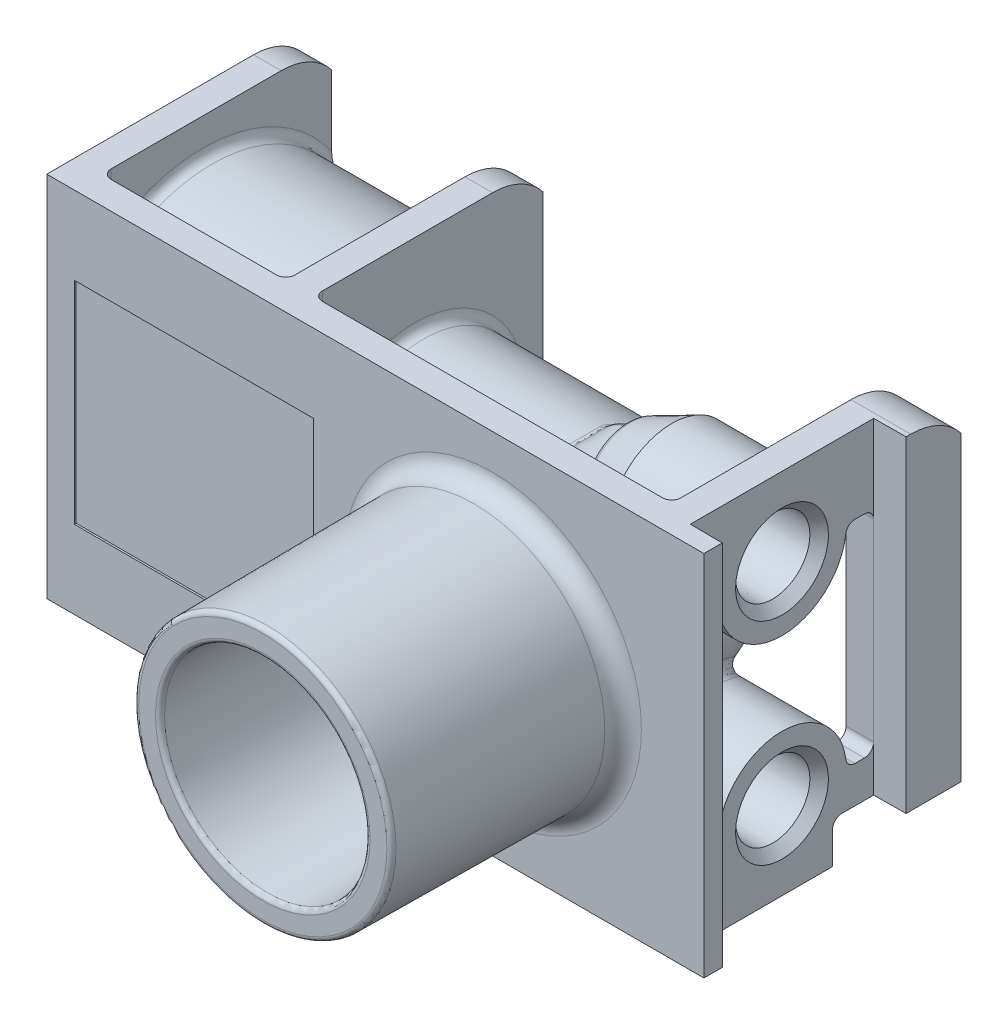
SolidWorks part; units mm, degrees
ref_plane "Plan de face" through (0, 0, 0) normal (0, 0, 1) x (1, 0, 0)
ref_plane "Plan de dessus" through (0, 0, 0) normal (0, 1, 0) x (1, 0, 0)
ref_plane "Plan de droite" through (0, 0, 0) normal (1, 0, 0) x (0, 0, -1)
sketch "Esquisse1" plane through (0, 0, 0) normal (0, 0, 1) x (1, 0, 0)
  line L1 (-64.8668, -0.5014) -> (6.6332, -0.5014)
  line L2 (-64.8668, -0.5014) -> (-64.8668, -40.5014)
  line L3 (-64.8668, -40.5014) -> (6.6332, -40.5014)
  line L4 (6.6332, -0.5014) -> (6.6332, -40.5014)
  dimension "D1" = 71.5
  dimension "D2" = 40
extrude "Extrusion1" add sketch "Esquisse1" against normal blind 3
sketch "Esquisse2" plane through (6.6332, 0, 0) normal (1, 0, 0) x (0, 0, -1)
  line L0 (3, -40.5014) -> (3, -0.5014) construction
  line L1 (3, -40.5014) -> (28, -40.5014)
  line L2 (3, -40.5014) -> (3, -0.5014)
  line L3 (3, -0.5014) -> (28, -0.5014)
  line L4 (28, -40.5014) -> (28, -0.5014)
  line L5 (3, -40.5014) -> (0, -40.5014) construction
  line L6 (3, -0.5014) -> (0, -0.5014) construction
  dimension "D1" = 25
extrude "Extrusion2" add sketch "Esquisse2" against normal blind 6.5
sketch "Esquisse3" plane through (6.6332, 0, 0) normal (1, 0, 0) x (0, 0, -1)
  line L1 (2, -41.9443) -> (22, -41.9443)
  line L2 (2, -41.9443) -> (2, 1.2411)
  line L3 (2, 1.2411) -> (22, 1.2411)
  line L4 (22, -41.9443) -> (22, 1.2411)
  line L6 (0, -40.5014) -> (0, -0.5014) construction
  dimension "D1" = 2
  dimension "D2" = 20
extrude "Enlèv. mat.-Extru.1" cut sketch "Esquisse3" against normal blind 3.5 draft 0.5
sketch "Esquisse4" plane through (-64.8668, 0, 0) normal (-1, 0, 0) x (0, 0, 1)
  line L0 (-28, -0.5014) -> (-28, -40.5014)
  line L1 (-28, -0.5014) -> (-3, -0.5014)
  line L2 (-28, -40.5014) -> (-3, -40.5014)
  line L3 (-3, -0.5014) -> (-3, -40.5014)
extrude "Extrusion3" add sketch "Esquisse4" against normal blind 3
sketch "Esquisse8" plane through (-64.8668, 0, 0) normal (-1, 0, 0) x (0, 0, 1)
  line L0 (0, -20.5014) -> (-24.0316, -20.5014) construction
  line L1 (0, -0.5014) -> (0, -40.5014) construction
  line L2 (-14, -15.5521) -> (-14, -25.5172) construction
  line L4 (-28, -0.5014) -> (-28, -40.5014) construction
  line L5 (-28, -12.7887) -> (-28, -28.2806)
  line L6 (0, -12.7887) -> (0, -28.2806)
  circle A0 centre (-14, -20.5346) radius 12.95
  arc A1 (0, -12.7887) -> (-28, -12.7887) centre (-14, -20.5346) ccw
  arc A2 (-28, -28.2806) -> (0, -28.2806) centre (-14, -20.5346) ccw
  dimension "D2" = 25.9
  dimension "D1" = 14
extrude "Extrusion5" add sketch "Esquisse8" against normal blind 26
sketch "Esquisse9" plane through (-64.8668, 0, 0) normal (-1, 0, 0) x (0, 0, 1)
  circle A0 centre (-14, -20.5346) radius 12.95
  arc A1 (-3, -13.7007) -> (-3, -27.3686) centre (-14, -20.5346) ccw construction
extrude "Enlèv. mat.-Extru.4" cut sketch "Esquisse9" against normal blind 23
sketch "Esquisse10" plane through (-38.8668, 0, 0) normal (1, 0, 0) x (0, 0, -1)
  line L0 (3, -8.9157) -> (3, -32.1536)
  line L2 (3, -8.9157) -> (3, -13.7007)
  line L4 (3, -27.3686) -> (3, -32.1536)
  line L5 (28, -28.2806) -> (28, -12.7887)
  line L8 (28, -28.2806) -> (28, -12.7887)
  arc A3 (28, -12.7887) -> (3, -8.9157) centre (14, -20.5346) ccw
  arc A4 (3, -27.3686) -> (3, -13.7007) centre (14, -20.5346) ccw
  arc A5 (3, -32.1536) -> (28, -28.2806) centre (14, -20.5346) ccw
  arc A6 (28, -12.7887) -> (3, -8.9157) centre (14, -20.5346) ccw
  arc A8 (3, -32.1536) -> (28, -28.2806) centre (14, -20.5346) ccw
  dimension "D1" = 0
extrude "Extrusion6" add sketch "Esquisse10" against normal blind 3
sketch "Esquisse11" plane through (-38.8668, 0, 0) normal (1, 0, 0) x (0, 0, -1)
  circle A0 centre (14, -20.5346) radius 8
  circle A1 centre (14, -20.5346) radius 11.01
extrude "Extrusion11" add sketch "Esquisse11" along normal blind 35
sketch "Esquisse21" plane through (0, -0.5014, 0) normal (0, 1, 0) x (-1, 0, 0)
  line L0 (27.3668, -3) -> (1.7447, -28.6221)
  line L1 (-0.1332, -3) -> (61.8668, -3) construction
  line L2 (27.3668, -3) -> (1.7447, -3)
  line L3 (1.7447, -3) -> (1.7447, -28.6221)
  dimension "D1" = 45
extrude "Enlèv. mat.-Extru.6" cut sketch "Esquisse21" against normal blind 35
sketch "Esquisse22" plane through (0, 0, 0) normal (0, 0, 1) x (1, 0, 0)
  line L1 (-27.3668, -20.0655) -> (-27.3668, -21.0038)
  line L2 (-27.3668, -20.0655) -> (-27.3668, -21.0038)
  circle A0 centre (-16.3668, -20.5346) radius 8 construction
  arc A1 (-27.3668, -21.0038) -> (-27.3668, -20.0655) centre (-16.3668, -20.5346) ccw
  arc A2 (-27.3668, -21.0038) -> (-27.3668, -20.0655) centre (-16.3668, -20.5346) ccw
  circle A3 centre (-16.3668, -20.5346) radius 8
  dimension "D1" = 0
extrude "Extrusion13" add sketch "Esquisse22" against normal up to surface (3 mm away)
sketch "Esquisse23" plane through (0, 0, 0) normal (0, 0, 1) x (1, 0, 0)
  line L0 (6.6332, -40.5014) -> (6.6332, -0.5014) construction
  circle A0 centre (-16.3668, -20.5014) radius 8
  dimension "D1" = 23
  dimension "D2" = 16
extrude "Enlèv. mat.-Extru.7" cut sketch "Esquisse23" against normal blind 3
ref_plane "Plan2" through (3.3166, 0, 3.3166) normal (0.7071, 0, 0.7071) x (0.7071, 0, -0.7071)
ref_plane "Plan3" through (-15.1884, 0, -15.1884) normal (0.7071, 0, 0.7071) x (0.7071, 0, -0.7071)
ref_plane "Plan4" through (-16.35, 0, 0) normal (1, 0, 0) x (0, 0, -1)
sketch "Esquisse26" plane through (-16.35, 0, 0) normal (1, 0, 0) x (0, 0, -1)
  line L0 (14, -9.5346) -> (14, -12.5346)
  line L1 (14, -28.5346) -> (14, -31.5346)
  line L2 (14, -5.5173) -> (14, -36.6039) construction
  arc A0 (14, -28.5346) -> (14, -12.5346) centre (14, -20.5346) ccw
  arc A1 (14, -31.5346) -> (14, -9.5346) centre (14, -20.5346) ccw
revolve "Révolution3" add sketch "Esquisse26" angle 80 about L2
fillet "Congé8" radius 11 1 edges at (-5.3568, -20.5346, -25.01)
sketch "Esquisse29" plane through (-15.1884, 0, -15.1884) normal (0.7071, 0, 0.7071) x (0.7071, 0, -0.7071)
  arc A0 (8.9912, -17.7858) -> (8.9427, -23.4676) centre (-6.2699, -20.4965) cw
  arc A1 (8.9912, -17.7858) -> (8.9427, -23.4676) centre (4.9828, -20.5926) cw
  spline S0 degree 3 poles (12.1313, -2031.3287) (-23.5012, -11.7673) (-12.084, -32.0247) (-1.0434, -31.5279) (-0.7411, -31.5065) (-0.4482, -31.4776) (-0.1647, -31.4421) (0.1096, -31.4005) (0.3747, -31.3537) (0.6306, -31.3021) (0.8773, -31.2463) (1.1148, -31.1869) (1.3429, -31.1246) (1.5615, -31.0598) (1.7707, -30.9933) (1.9716, -30.9249) (2.1674, -30.8543) (2.3609, -30.7802) (2.5539, -30.7022) (2.7464, -30.6201) (2.9383, -30.5338) (3.1297, -30.4434) (3.3204, -30.3488) (3.5104, -30.2498) (3.6997, -30.1465) (3.8882, -30.0388) (4.0758, -29.9266) (4.2625, -29.8098) (4.4481, -29.6885) (4.6325, -29.5626) (4.8157, -29.4319) (4.9975, -29.2966) (5.1778, -29.1564) (5.3565, -29.0115) (5.9672, -28.4945) (6.9008, -27.5312) (7.9346, -26.0145) (8.6795, -24.4203) (9.2953, -22.2912) (9.4618, -19.4403) (8.674, -16.3497) (7.1615, -13.78) (5.3038, -11.8814) (3.1138, -10.5122) (1.3165, -9.8962) (0.1055, -9.6632) (-0.4989, -9.5823) (-14.1435, -8.4558) (-28.8923, -38.6012) (42.6003, 1989.8096) knots -0.932697 -0.932697 -0.932697 -0.932697 0.009309 0.018343 0.027113 0.035631 0.043902 0.051933 0.059726 0.067285 0.074608 0.081695 0.088542 0.095147 0.101504 0.107609 0.113581 0.119579 0.125606 0.131664 0.137756 0.143883 0.150047 0.156249 0.162493 0.168778 0.175107 0.18148 0.1879 0.194366 0.20088 0.207443 0.214054 0.220715 0.227425 0.283564 0.336531 0.386173 0.435781 0.528386 0.630576 0.707885 0.785004 0.859006 0.930291 0.948493 0.966102 0.983236 2.136919 2.136919 2.136919 2.136919 only from (-1.6736, -31.5446) to (-1.6736, -9.5246) construction
extrude "Enlèv. mat.-Extru.8" cut sketch "Esquisse29" against normal mid plane 3
sketch "Esquisse30" plane through (-41.8668, 0, 0) normal (-1, 0, 0) x (0, 0, 1)
  circle A0 centre (-14, -20.5346) radius 8.225
  dimension "D1" = 16.45
extrude "Enlèv. mat.-Extru.9" cut sketch "Esquisse30" against normal blind 25.5 draft 0.5
sketch "Esquisse31" plane through (0, 0, 0) normal (0, 0, 1) x (1, 0, 0)
  line L0 (-16.3668, -12.5322) -> (-16.3668, -28.5371) construction
  circle A0 centre (-16.3668, -20.5346) radius 10.87
  circle A1 centre (-16.3668, -20.5346) radius 14
  dimension "D1" = 21.74
extrude "Extrusion14" add sketch "Esquisse31" along normal blind 25
chamfer "Chanfrein1" distance 2.9 angle 45.5 1 edges at (-8.3668, -20.5014, 0)
draft "Dépouille15" type of draft neutral plane draft angle 0.72 faces to draft 1 parameters "D1"=0.72
draft "Dépouille16" type of draft neutral plane draft angle 0.5 faces to draft 1 parameters "D1"=0.5
sketch "Esquisse32" plane through (3.1332, 0, 0) normal (1, 0, 0) x (0, 0, -1)
  line L0 (-2.9013, -20.5014) -> (32.837, -20.5014) construction
  line L1 (21.9695, -0.5014) -> (2.0305, -0.5014) construction
  line L2 (2.0305, -40.5014) -> (21.9695, -40.5014) construction
  line L3 (28, -40.5014) -> (28, -0.5014) construction
  circle A0 centre (12, -9.0014) radius 7
  circle A1 centre (12, -32.0014) radius 7
  dimension "D1" = 23
  dimension "D2" = 16
extrude "Extrusion15" add sketch "Esquisse32" against normal blind 12
sketch "Esquisse33" plane through (-8.8668, 0, 0) normal (-1, 0, 0) x (0, 0, 1)
  line L1 (-14.0068, -12.4742) -> (-5.9222, -12.4742)
  line L2 (-14.0068, -12.4742) -> (-5.9222, -12.4742)
  arc A2 (-14.0068, -12.4742) -> (-17.5344, -13.2875) centre (-14.0067, -20.5323) ccw
  arc A3 (-5.9222, -12.4742) -> (-17.5344, -13.2875) centre (-12, -9.0014) ccw
  arc A4 (-14.0068, -12.4742) -> (-17.5344, -13.2875) centre (-14.0067, -20.5323) ccw
  arc A5 (-5.9222, -12.4742) -> (-17.5344, -13.2875) centre (-12, -9.0014) ccw
  dimension "D1" = 0
extrude "Extrusion16" add sketch "Esquisse33" along normal blind 5 draft 25
sketch "Esquisse34" plane through (-8.8668, 0, 0) normal (-1, 0, 0) x (0, 0, 1)
  line L1 (-5.8847, -28.595) -> (-14.0068, -28.595)
  line L2 (-5.8847, -28.595) -> (-14.0068, -28.595)
  arc A2 (-17.5715, -27.7637) -> (-14.0068, -28.595) centre (-14.0067, -20.537) ccw
  arc A3 (-17.5715, -27.7637) -> (-5.8847, -28.595) centre (-12, -32.0014) ccw
  arc A4 (-17.5715, -27.7637) -> (-14.0068, -28.595) centre (-14.0067, -20.537) ccw
  arc A5 (-17.5715, -27.7637) -> (-5.8847, -28.595) centre (-12, -32.0014) ccw
  dimension "D1" = 0
extrude "Extrusion17" add sketch "Esquisse34" along normal blind 5 draft 25
sketch "Esquisse35" plane through (0, 0, -3) normal (0, 0, -1) x (-1, 0, 0)
  line L0 (12.3566, -10.5225) -> (20.2801, -10.381)
  arc A0 (12.3566, -10.5225) -> (20.2801, -10.381) centre (16.3597, -12.7687) cw
  spline S0 degree 3 poles (16.3668, -9.5246) (16.3468, -9.5246) (16.3468, -31.5446) (16.3668, -31.5446) knots 0 0 0 0 1 1 1 1 weights 1 0.333333 0.333333 1 construction
extrude "Extrusion18" add sketch "Esquisse35" along normal blind 13.53
fillet "Congé12" radius 1 4 edges at (-10.8562, -11.0029, -6.267) (-6.7706, -15.1371, -8.6305) (-6.9892, -14.9946, -15.6168) (-11.0073, -11.5495, -17.4342)
fillet "Congé13" radius 1 3 edges at (-13.8668, -9.9022, -16.8713) (-13.8668, -4.3387, -12.2306)
fillet "Congé14" radius 1 1 edges at (-16.9637, -8.2183, -16.53)
fillet "Congé15" radius 1 5 edges at (-20.1642, -10.2002, -4.7044) (-19.4352, -9.7521, -16.2264)
fillet "Congé17" radius 1 3 edges at (-38.6118, -21.0038, -3) (-37.3632, -21.5603, -3) (-6.3992, -25.2107, -3)
sketch "Esquisse36" plane through (3.1332, 0, 0) normal (1, 0, 0) x (0, 0, -1)
  circle A0 centre (12, -9.0014) radius 4.05
  circle A1 centre (12, -32.0014) radius 4.05
  dimension "D1" = 8.1
  dimension "D2" = 8.1
extrude "Enlèv. mat.-Extru.10" cut sketch "Esquisse36" against normal blind 11.5 draft 0.5
chamfer "Chanfrein2" distance 1 angle 45 2 edges at (3.1332, -4.9514, -12) (3.1332, -27.9514, -12)
sketch "Esquisse37" plane through (0, 0, 0) normal (0, 0, 1) x (1, 0, 0)
  circle A0 centre (-16.3768, -10.7346) radius 1
  circle A3 centre (-16.3668, -20.5346) radius 14.2182 construction
  dimension "D1" = 9.8
  dimension "D2" = 2
sketch "Esquisse38" plane through (-8.3668, 0, 0) normal (1, 0, 0) x (0, 0, -1)
  line L0 (12, -8.6485) -> (12, -14.9077) construction
  circle A0 centre (12.0367, -10.8014) radius 0.7
  point P5 (12, -9.0014)
  dimension "D1" = 1.8
  dimension "D2" = 1.4
extrude "Enlèv. mat.-Extru.12" cut sketch "Esquisse38" against normal blind 9
sketch "Esquisse40" plane through (-13.8668, 0, 0) normal (-1, 0, 0) x (0, 0, 1)
  line L0 (-14.6685, -30.3736) -> (-9.3315, -30.3736)
  line L1 (-14.6685, -32.0014) -> (-14.6685, -30.3736)
  line L2 (-9.3315, -32.0014) -> (-9.3315, -30.3736)
  arc A0 (-9.3315, -32.0014) -> (-14.6685, -32.0014) centre (-12, -31.339) cw
extrude "Extrusion19" add sketch "Esquisse40" along normal blind 26
sketch "Esquisse41" plane through (-8.3668, 0, 0) normal (1, 0, 0) x (0, 0, -1)
  line L0 (11.9964, -29.3557) -> (11.9964, -34.0799) construction
  line L1 (13.6005, -32.0014) -> (10.1067, -32.0014) construction
  circle A0 centre (11.9964, -31.5014) radius 1.475
  dimension "D2" = 2.95
  dimension "D1" = 0.5
extrude "Enlèv. mat.-Extru.13" cut sketch "Esquisse41" against normal blind 36 draft 1
fillet "Congé22" radius 1 2 edges at (-27.6165, -31.5243, -14.6685)
fillet "Congé23" radius 1 3 edges at (-16.2824, -31.5443, -9.3315) (-32.2832, -30.5059, -9.3315)
fillet "Congé26" radius 1 6 edges at (-6.5535, -25.5265, -9.34) (-10.7807, -29.3535, -17.5037) (-7.474, -26.5651, -16.4098) (-10.9575, -30.1242, -6.2748) (-13.8668, -31.257, -7.8747)
fillet "Congé27" radius 1 5 edges at (-14.2415, -31.3462, -16.668) (-14.1202, -31.7853, -7.2419) (-13.8668, -36.6674, -12.1512)
sketch "Esquisse42" plane through (6.6332, 0, 0) normal (1, 0, 0) x (0, 0, -1)
  line L0 (17.5, -36.0014) -> (17.5, -42.8158)
  line L1 (17.5, -36.0014) -> (30.8798, -36.0014)
  line L2 (17.5, -42.8158) -> (30.8798, -42.8158)
  line L3 (30.8798, -36.0014) -> (30.8798, -42.8158)
  line L4 (28, -40.5014) -> (28, -0.5014) construction
  line L5 (28, -40.5014) -> (22, -40.5014) construction
  dimension "D1" = 10.5
  dimension "D2" = 4.5
extrude "Enlèv. mat.-Extru.14" cut sketch "Esquisse42" against normal blind 30
sketch "Esquisse43" plane through (6.6332, 0, 0) normal (1, 0, 0) x (0, 0, -1)
  line L0 (2.0305, -20.5014) -> (34.5975, -20.5014) construction
  line L1 (2.0305, -0.5014) -> (2.0305, -40.5014) construction
  line L2 (28, -0.5014) -> (22, -0.5014) construction
  line L3 (28, -36.0014) -> (28, -0.5014) construction
  line L4 (22.5, -0.5014) -> (22.5, 1.989)
  line L5 (22.5, 1.989) -> (29.5, 1.989)
  line L6 (29.5, 1.989) -> (29.5, -7.5014)
  line L7 (29.5, -42.9919) -> (29.5, -33.5014)
  line L8 (22.5, -42.9919) -> (29.5, -42.9919)
  line L9 (22.5, -40.5014) -> (22.5, -42.9919)
  arc A0 (29.5, -7.5014) -> (22.5, -0.5014) centre (22.5, -7.5014) ccw
  arc A1 (29.5, -33.5014) -> (22.5, -40.5014) centre (22.5, -33.5014) cw
  dimension "D1" = 7
  dimension "D2" = 5.5
extrude "Enlèv. mat.-Extru.15" cut sketch "Esquisse43" against normal blind 80
fillet "Congé28" radius 1 1 edges at (-3.0805, -36.0014, -17.5)
sketch "Esquisse44" plane through (3.1332, 0, 0) normal (1, 0, 0) x (0, 0, -1)
  line L0 (5, -9.0014) -> (3, -9.0014)
  line L1 (3, -9.0014) -> (3, -32.0014)
  line L2 (3, -32.0014) -> (5, -32.0014)
  line L3 (19, -32.0014) -> (21.9695, -32.0014)
  line L4 (21.9695, -36.0014) -> (21.9695, -0.5014) construction
  line L5 (21.9695, -32.0014) -> (21.9695, -9.0014)
  line L6 (21.9695, -9.0014) -> (19, -9.0014)
  line L7 (3, -0.5014) -> (3, -40.5014) construction
  arc A0 (5, -9.0014) -> (19, -9.0014) centre (12, -9.0014) ccw
  arc A1 (19, -32.0014) -> (5, -32.0014) centre (12, -32.0014) ccw
  arc A2 (18.3522, -11.9424) -> (5.1901, -10.6217) centre (12, -9.0014) ccw construction
  arc A3 (5.1764, -30.4399) -> (18.3731, -29.1061) centre (12, -32.0014) ccw construction
extrude "Enlèv. mat.-Extru.16" cut sketch "Esquisse44" against normal blind 5
ref_plane "Plan5" through (0, -36.0014, 0) normal (0, -1, 0) x (1, 0, 0)
sketch "Esquisse45" plane through (0, -36.0014, 0) normal (0, -1, 0) x (1, 0, 0)
  line L0 (6.6332, -28) -> (6.6332, -22) construction
  line L1 (0.1332, -28) -> (6.6332, -28) construction
  line L2 (-36.3668, -17.5) -> (-40.8668, -17.5)
  line L3 (-36.3668, -26.5) -> (-40.8668, -26.5)
  line L4 (-40.8668, -17.5) -> (-40.8668, -26.5)
  arc A0 (-36.3668, -26.5) -> (-36.3668, -17.5) centre (-36.3668, -22) ccw
  dimension "D2" = 9
  dimension "D1" = 43
  dimension "D3" = 6
extrude "Extrusion20" add sketch "Esquisse45" against normal blind 15.5 draft 1
sketch "Esquisse46" plane through (-38.8668, 0, 0) normal (1, 0, 0) x (0, 0, -1)
  line L3 (28, -37.8315) -> (28, -28.2806)
  line L4 (3, -32.1536) -> (3, -40.5014)
  line L5 (3, -40.5014) -> (22.5, -40.5014)
  line L6 (28, -37.8315) -> (28, -28.2806)
  line L7 (3, -32.1536) -> (3, -40.5014)
  line L8 (3, -40.5014) -> (22.5, -40.5014)
  line L9 (22.5, -0.5014) -> (3, -0.5014)
  line L10 (3, -0.5014) -> (3, -8.9157)
  line L11 (28, -12.7887) -> (28, -3.1713)
  line L12 (22.5, -0.5014) -> (3, -0.5014)
  line L13 (3, -0.5014) -> (3, -8.9157)
  line L14 (28, -12.7887) -> (28, -3.1713)
  arc A2 (22.5, -40.5014) -> (28, -37.8315) centre (22.5, -33.5014) ccw
  arc A3 (3, -32.1536) -> (28, -28.2806) centre (14, -20.5346) ccw
  arc A4 (22.5, -40.5014) -> (28, -37.8315) centre (22.5, -33.5014) ccw
  arc A5 (3, -32.1536) -> (28, -28.2806) centre (14, -20.5346) ccw
  arc A6 (28, -3.1713) -> (22.5, -0.5014) centre (22.5, -7.5014) ccw
  arc A7 (28, -12.7887) -> (3, -8.9157) centre (14, -20.5346) ccw
  arc A8 (28, -3.1713) -> (22.5, -0.5014) centre (22.5, -7.5014) ccw
  arc A9 (28, -12.7887) -> (3, -8.9157) centre (14, -20.5346) ccw
  dimension "D1" = 0
  dimension "D2" = 0
extrude "Extrusion21" add sketch "Esquisse46" against normal blind 3
sketch "Esquisse47" plane through (0, -36.0014, 0) normal (0, -1, 0) x (1, 0, 0)
  circle A0 centre (-36.3668, -22) radius 4.5
extrude "Enlèv. mat.-Extru.17" cut sketch "Esquisse47" along normal blind 13
fillet "Congé29" radius 1 7 edges at (-38.8668, -33.8437, -3) (-38.8668, -26.2287, -3.7107) (-38.8668, -34.0884, -12) (-38.8668, -31.6297, -14.983) (-38.8668, -31.5621, -9.3315) (-38.8668, -30.609, -9.1894)
sketch "Esquisse48" plane through (-41.8668, 0, 0) normal (-1, 0, 0) x (0, 0, 1)
  circle A0 centre (-14, -20.5346) radius 8.225 construction
  circle A1 centre (-14, -20.5346) radius 8.225
extrude "Enlèv. mat.-Extru.18" cut sketch "Esquisse48" against normal blind 12 draft 0.5
fillet "Congé38" radius 0.9 1 edges at (-38.8668, -31.236, -16.5886)
fillet "Congé40" radius 1 14 edges at (-12.784, -10.8511, -17.8256) (-13.6708, -10.1612, -16.7517) (-13.8648, -9.1241, -16.093) (-13.8668, -8.9478, -15.7652) (-13.8668, -8.9143, -11.7495) (-12.591, -10.1481, -5.7975) (-12.5506, -10.2072, -4.7291) (-12.7029, -9.9941, -3.4745) (-17.3293, -8.282, -3) (-20.1969, -10.1702, -3) (-21.163, -10.6242, -3) (-37.2011, -19.3869, -3) (-38.6118, -20.0655, -3)
fillet "Congé41" radius 1 3 edges at (-61.8668, -4.7232, -16.4495) (-51.8668, -8.9157, -3) (-41.8668, -4.7232, -16.4495)
fillet "Congé42" radius 1 3 edges at (-61.8668, -36.346, -16.4495) (-41.8668, -36.346, -16.4495) (-51.8668, -32.1536, -3)
fillet "Congé46" radius 10 8 edges at (-8.8775, -23.4664, -21.5247) (-8.3884, -17.9857, -21.1522) (-9.2606, -18.0448, -22.0379) (-9.7228, -20.625, -22.7753) (-7.6014, -20.625, -20.654)
ref_plane "Plan6" through (0, -5.0014, 0) normal (0, 1, 0) x (-1, 0, 0)
ref_plane "Plan7" through (0, -36.0014, 0) normal (0, -1, 0) x (1, 0, 0)
sketch "Esquisse53" plane through (-41.8668, 0, 0) normal (-1, 0, 0) x (0, 0, 1)
  circle A0 centre (-14, -20.5346) radius 7.725
  circle A2 centre (-14, -20.5346) radius 9.125
  circle A3 centre (-14, -20.5346) radius 9.125
  dimension "D1" = 0.9
extrude "Enlèv. mat.-Extru.22" cut sketch "Esquisse53" against normal blind 3.5 draft 0.5
draft "Dépouille17" type of draft neutral plane draft angle 0.5 faces to draft 1 parameters "D1"=0.5
fillet "Congé47" radius 2 1 edges at (-2.1486, -20.5346, 0)
fillet "Congé48" radius 0.5 2 edges at (-5.1826, -20.5346, 25) (-2.3668, -20.5346, 25)
extrude "Enlèv. mat.-Extru.23" cut sketch "Esquisse37" against normal blind 14 draft 0.5
sketch "Esquisse55" plane through (-41.8668, 0, 0) normal (-1, 0, 0) x (0, 0, 1)
  line L0 (-13.2242, -32.1031) -> (-14.713, -29.0995)
  line L1 (-10.2821, -31.5168) -> (-10.07, -28.1779)
  line L2 (-14, -20.5346) -> (-11.2161, -34.3831) construction
  line L3 (-14, -20.5346) -> (-14, -37.0988) construction
  circle A0 centre (-14, -20.5346) radius 8.5945 construction
  arc A1 (-13.2242, -32.1031) -> (-10.2821, -31.5168) centre (-14, -20.5346) ccw
  circle A2 centre (-14, -20.5346) radius 8.5945
  arc A3 (-14.713, -29.0995) -> (-10.07, -28.1779) centre (-14, -20.5346) ccw
  circle A4 centre (-14, -20.5346) radius 11.5945 construction
  dimension "D3" = 3
  dimension "D4" = 30
  dimension "D5" = 15
  dimension "D6" = 11.367
  dimension "D1" = 0.5
  dimension "D2" = 3
sketch "Esquisse56" plane through (-38.3668, 0, 0) normal (-1, 0, 0) x (0, 0, 1)
  circle A1 centre (-14, -20.5346) radius 8.3945
  circle A2 centre (-14, -20.5346) radius 9.2945
  circle A3 centre (-14, -20.5346) radius 9.2945
  dimension "D1" = 0.2
  dimension "D2" = 0.9
extrude "Extrusion22" add sketch "Esquisse56" along normal blind 0.5 draft 0.5
sketch "Esquisse57" plane through (-41.8668, 0, 0) normal (-1, 0, 0) x (0, 0, 1)
  circle A1 centre (-14, -20.5346) radius 12.0493
  arc A2 (-1.0507, -20.5346) -> (-1.0507, -20.5346) centre (-14, -20.5346) ccw
  circle A3 centre (-14, -20.5346) radius 12.9493
  dimension "D1" = 0.2
  dimension "D2" = 0.9
extrude "Extrusion23" add sketch "Esquisse57" along normal blind 1.4 draft 0.5
sketch "Esquisse62" plane through (-41.8668, 0, 0) normal (-1, 0, 0) x (0, 0, 1)
  circle A1 centre (-14, -20.5346) radius 12.0493
  circle A2 centre (-14, -20.5346) radius 12.0493
  circle A4 centre (-14, -20.5346) radius 8.125
  circle A5 centre (-14, -20.5346) radius 8.125
  dimension "D1" = 0
  dimension "D2" = 1
extrude "Enlèv. mat.-Extru.29" cut sketch "Esquisse62" against normal blind 1 draft 0.5
sketch "Esquisse54" plane through (0, -36.0014, 0) normal (0, -1, 0) x (1, 0, 0)
  circle A0 centre (-36.3668, -22) radius 2.8
extrude "Enlèv. mat.-Extru.24" cut sketch "Esquisse54" against normal blind 8.2
sketch "Esquisse59" plane through (-64.8668, 0, 0) normal (-1, 0, 0) x (0, 0, 1)
  line L0 (-14, -20.5346) -> (-14, -3.5225) construction
  circle A1 centre (-14, -8.5346) radius 1.5
  dimension "D1" = 12
extrude "Enlèv. mat.-Extru.26" cut sketch "Esquisse59" against normal blind 20.5 draft 0.5
sketch "Esquisse60" plane through (-8.3668, 0, 0) normal (1, 0, 0) x (0, 0, -1)
  circle A0 centre (12, -9.0014) radius 3.9496 construction
  circle A1 centre (12, -9.0014) radius 3.9496
  circle A2 centre (12, -32.0014) radius 3.9496 construction
  circle A3 centre (12, -32.0014) radius 3.9496
extrude "Enlèv. mat.-Extru.27" cut sketch "Esquisse60" against normal blind 2.5 draft 25
chamfer "Chanfrein3" distance 0.2 angle 45 1 edges at (-36.3668, -27.8014, -24.8)
sketch "Esquisse61" plane through (0, -20.5014, 0) normal (0, 1, 0) x (-1, 0, 0)
  line L3 (38.8668, -26.7706) -> (38.8668, -25.0099)
  line L4 (38.8668, -25.0099) -> (32.6657, -25.0099)
  line L5 (36.3668, -26.7706) -> (38.8668, -26.7706)
  line L6 (38.8668, -26.7706) -> (38.8668, -25.0099)
  line L7 (38.8668, -25.0099) -> (32.6657, -25.0099)
  line L8 (36.3668, -26.7706) -> (38.8668, -26.7706)
  arc A1 (32.6657, -25.0099) -> (36.3668, -26.7706) centre (36.3668, -22) ccw
  arc A2 (32.6657, -25.0099) -> (36.3668, -26.7706) centre (36.3668, -22) ccw
  dimension "D1" = 0
extrude "Enlèv. mat.-Extru.28" cut sketch "Esquisse61" against normal blind 5
fillet "Congé49" radius 1 5 edges at (-38.8668, -7.1924, -3) (-38.8668, -14.8406, -3.7107) (-35.8228, -25.5014, -25.0099) (-38.8668, -23.0014, -25.0099) (-38.8668, -9.9906, -17.169)
fillet "Congé50" radius 1 5 edges at (-32.0237, -29.4632, -20.4421) (-37.1668, -31.0024, -17.4127) (-38.5109, -31.1937, -17.4161)
fillet "Congé51" radius 1 14 edges at (-61.8668, -37.3919, -3) (-41.8668, -3.6442, -3) (-61.8668, -3.6442, -3) (-61.8668, -7.1101, -3.0537) (-41.8668, -7.1101, -3.0537) (-41.9956, -7.7068, -3.6079) (-61.738, -7.7068, -3.6079) (-41.8668, -37.3919, -3) (-41.8668, -33.9591, -3.0537) (-61.8668, -33.9591, -3.0537) (-61.738, -33.3624, -3.6079) (-41.9956, -33.3624, -3.6079)
fillet "Congé52" radius 1 4 edges at (0.1332, -2.0014, -12) (0.1332, -39.0014, -12)
fillet "Congé53" radius 1 8 edges at (1.1332, -32.0014, -19) (1.1332, -32.0014, -3) (1.1332, -32.0014, -5) (1.6332, -32.0014, -21.9695) (1.1332, -9.0014, -5) (1.6332, -9.0014, -21.9695) (1.1332, -9.0014, -3) (1.1332, -9.0014, -19)
fillet "Congé54" radius 0.5 5 edges at (-13.8732, -32.3241, -14.5669) (-13.9181, -32.1344, -9.3681) (-13.8668, -34.0884, -12.0062) (-14.4003, -31.5245, -14.9577) (-14.4256, -31.5532, -8.9702)
fillet "Congé55" radius 1 6 edges at (-38.8668, -34.1396, -17.4675) (-38.8668, -30.7514, -26.5916) (-38.8668, -25.5014, -26.3466) (-38.5739, -25.2085, -25.3028) (-38.8668, -32.1145, -17.4187) (-38.7395, -31.5537, -17.1062)
fillet "Congé58" radius 0.5 1 edges at (-40.8668, -20.5346, -4.8837)
ref_plane "Plan8" through (0, 0, -14) normal (0, 0, 1) x (1, 0, 0)
sketch "Esquisse63" plane through (0, 0, -14) normal (0, 0, 1) x (1, 0, 0)
  line L0 (-38.8668, -11.4358) -> (-38.3668, -11.4358)
  line L1 (-38.8668, -3.1713) -> (-38.8668, -37.8315) construction
  line L2 (-38.8668, -11.4358) -> (-38.8668, -29.6335) construction
  line L3 (-38.3668, -20.5346) -> (-56.0747, -20.5346) construction
  line L6 (-38.3668, -11.4358) -> (-38.8668, -11.9358)
  line L7 (-38.8668, -11.9358) -> (-38.8668, -11.4358)
  line L8 (-38.3668, -12.3402) -> (-38.3668, -28.7291) construction
revolve "Enlèvement de matière-Révolution1" cut sketch "Esquisse63" angle 360 about L3
sketch "Esquisse64" plane through (0, 0, -14) normal (0, 0, 1) x (1, 0, 0)
  line L0 (-43.2668, -7.7731) -> (-42.7668, -7.7731)
  line L2 (-43.2668, -8.2731) -> (-43.2668, -7.7731)
  line L4 (-43.2668, -8.4731) -> (-43.2668, -32.5961) construction
  line L5 (-43.2668, -7.7731) -> (-43.2668, -33.2961) construction
  line L6 (-43.2668, -8.2731) -> (-42.7668, -7.7731)
  line L7 (-43.2668, -20.5346) -> (-57.0129, -20.5346) construction
revolve "Enlèvement de matière-Révolution2" cut sketch "Esquisse64" angle 360 about L7
sketch "Esquisse65" plane through (0, 0, 0) normal (0, 0, 1) x (1, 0, 0)
  line L0 (-64.8668, -0.5014) -> (-64.8668, -40.5014) construction
  line L1 (-61.8668, -9.0014) -> (-35.8668, -9.0014)
  line L2 (-61.8668, -9.0014) -> (-61.8668, -32.0014)
  line L3 (-61.8668, -32.0014) -> (-35.8668, -32.0014)
  line L4 (-35.8668, -9.0014) -> (-35.8668, -32.0014)
  line L5 (-64.8668, -40.5014) -> (6.6332, -40.5014) construction
  dimension "D1" = 26
  dimension "D2" = 23
  dimension "D3" = 3
  dimension "D4" = 8.5
extrude "Extrusion24" cut sketch "Esquisse65" against normal blind 0.2
sketch "Esquisse66" plane through (-17.3668, 0, 0) normal (1, 0, 0) x (0, 0, -1)
  circle A0 centre (12.0367, -10.8014) radius 0.7
